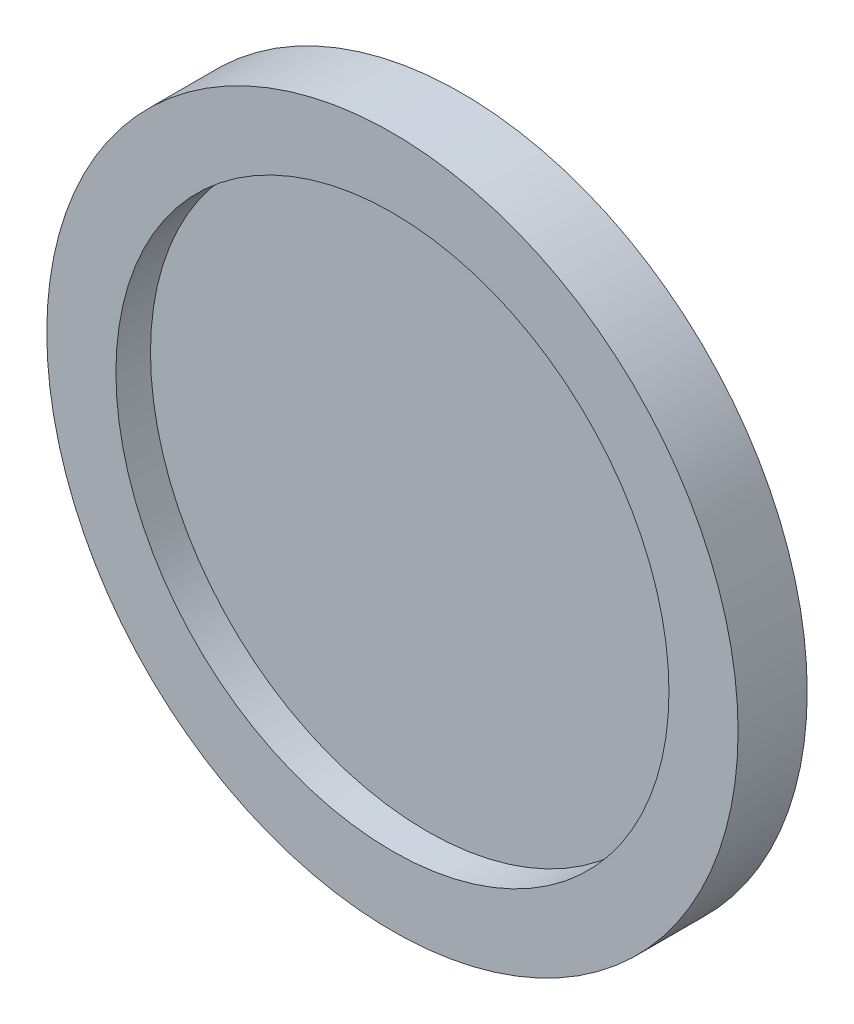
SolidWorks part; units mm, degrees
ref_plane "Спереди" through (0, 0, 0) normal (0, 0, 1) x (1, 0, 0)
ref_plane "Сверху" through (0, 0, 0) normal (0, 1, 0) x (1, 0, 0)
ref_plane "Справа" through (0, 0, 0) normal (1, 0, 0) x (0, 0, -1)
sketch "Эскиз2" plane through (0, 0, 0) normal (0, 0, 1) x (1, 0, 0)
  circle A0 centre (0, 0) radius 5
  dimension "D1" = 10
extrude "Бобышка-Вытянуть2" add sketch "Эскиз2" along normal blind 1
sketch "Эскиз3" plane through (0, 0, 1) normal (0, 0, 1) x (1, 0, 0)
  circle A0 centre (0, 0) radius 4
  circle A1 centre (0, 0) radius 5 construction
  dimension "D1" = 1
extrude "Вырез-Вытянуть1" cut sketch "Эскиз3" against normal blind 0.5
